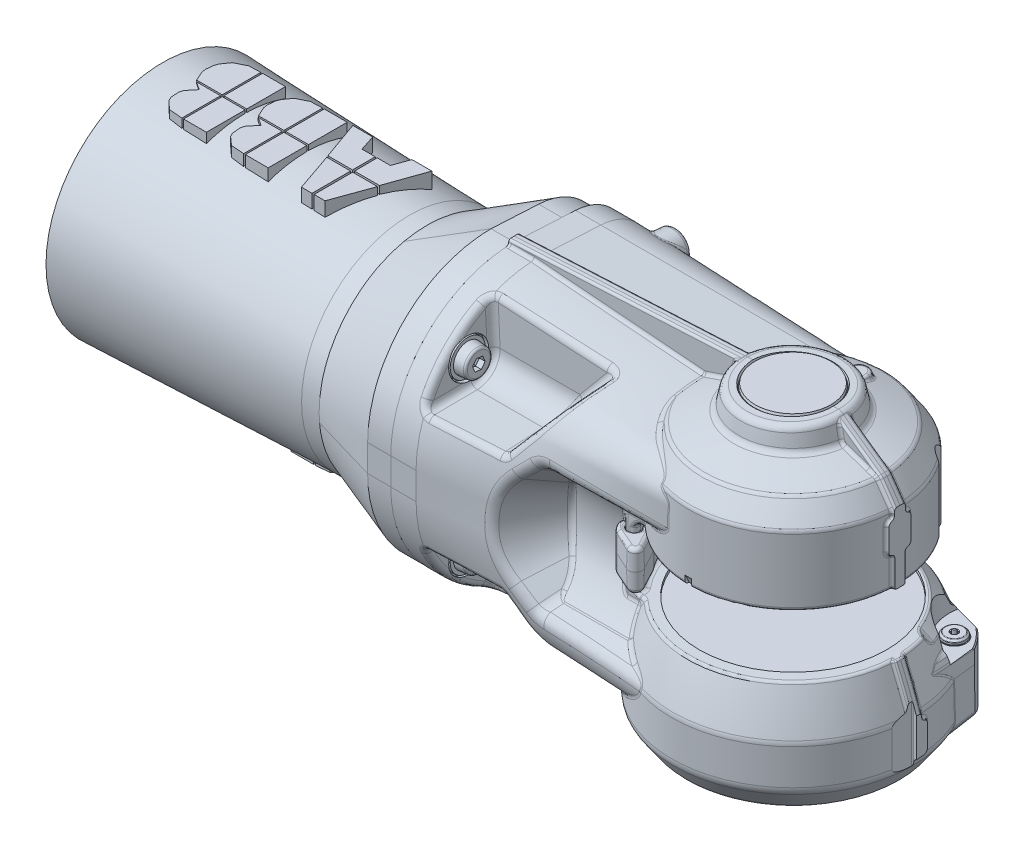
SolidWorks part; units mm, degrees
other "<socket head cap screws-8.8 gb>-<Chamfer1>"
other "<plain washers>-<Base-Extrude>"
ref_plane "Front Plane" through (0, 0, 0) normal (0, 0, 1) x (1, 0, 0)
ref_plane "Top Plane" through (0, 0, 0) normal (0, 1, 0) x (1, 0, 0)
ref_plane "Right Plane" through (0, 0, 0) normal (1, 0, 0) x (0, 0, -1)
imported_body "Imported1"
imported_body "Imported2"
imported_body "Imported3"
imported_body "Imported4"
imported_body "Imported5"
imported_body "Imported6"
ref_plane "Front-plain washers" through (633, 38.3022, 1218.6394) normal (-1, 0, 0) x (0, 0, 1)
ref_plane "Top-plain washers" through (633, 38.3022, 1218.6394) normal (0, 1, 0) x (0, 0, 1)
ref_plane "Right-plain washers" through (633, 38.3022, 1218.6394) normal (0, 0, 1) x (1, 0, 0)
inserted part "plain washers"
move or copy body "Body-Move/Copy2" placed by mates yes
ref_plane "Front-socket head cap screws-8.8 gb" through (639.6, 38.3022, 1218.6394) normal (0, 0.9242, 0.3818) x (-1, 0, 0)
ref_plane "Top-socket head cap screws-8.8 gb" through (639.6, 38.3022, 1218.6394) normal (0, -0.3818, 0.9242) x (-1, 0, 0)
ref_plane "Right-socket head cap screws-8.8 gb" through (639.6, 38.3022, 1218.6394) normal (-1, 0, 0) x (0, -0.9242, -0.3818)
ref_plane "Plane1-socket head cap screws-8.8 gb" through (634.6, 38.3022, 1218.6394) normal (-1, 0, 0) x (0, -0.9242, -0.3818)
inserted part "socket head cap screws-8.8 gb"
move or copy body "Body-Move/Copy4"
sketch "Sketch1" plane through (633, 0, 0) normal (1, 0, 0) x (0, 0, -1)
  point P0 (-1218.6394, -38.3022)
  point P1 (-1141, 0)
pattern_sketch "Sketch-Pattern1"
